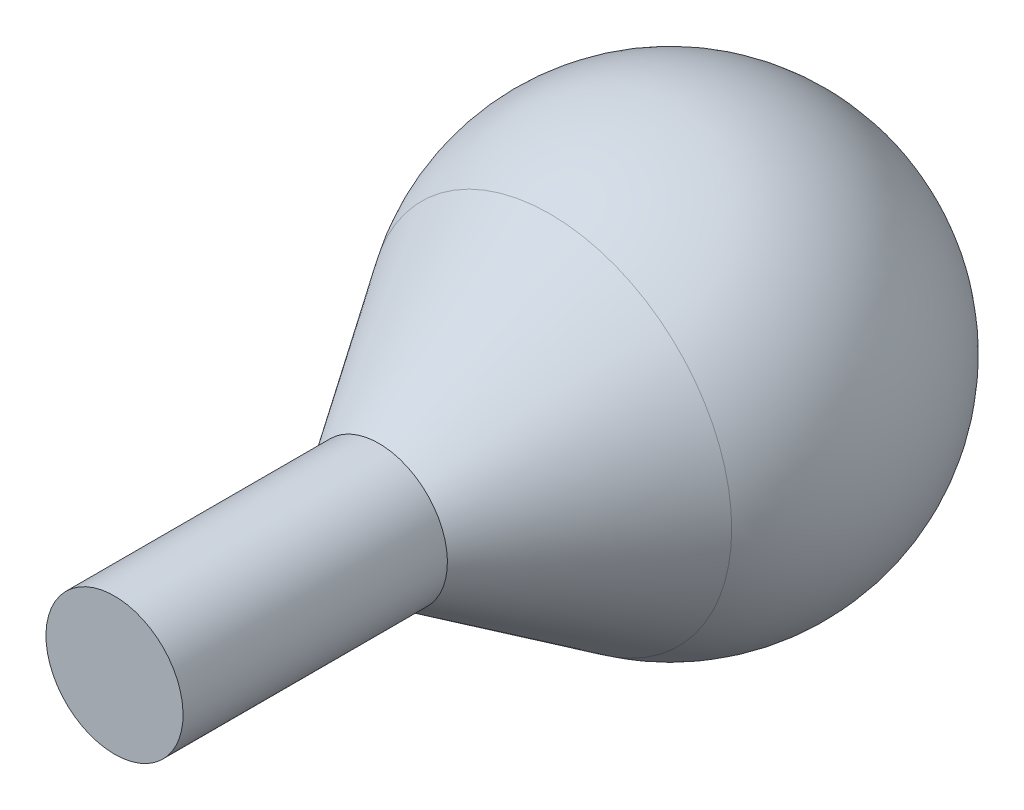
SolidWorks part; units mm, degrees
ref_plane "Plan de face" through (0, 0, 0) normal (0, 0, 1) x (1, 0, 0)
ref_plane "Plan de dessus" through (0, 0, 0) normal (0, 1, 0) x (1, 0, 0)
ref_plane "Plan de droite" through (0, 0, 0) normal (1, 0, 0) x (0, 0, -1)
sketch "Esquisse1" plane through (0, 0, 0) normal (1, 0, 0) x (0, 0, -1)
  line L0 (0, 0) -> (27, 0)
  line L1 (27, 0) -> (44.4759, 11.5583)
  line L2 (0, 0) -> (0, -7)
  line L3 (0, -7) -> (79, -7)
  line L4 (79, -7) -> (79, 115.9303) construction
  arc A0 (44.4759, 11.5583) -> (79, -7) centre (56.75, -7) cw
  point P7 (61.6981, 23.731)
  point P8 (48.4867, 7.8872)
  point P10 (73.7418, -13)
  dimension "D1" = 22.25
  dimension "D2" = 27
  dimension "D3" = 7
  dimension "D4" = 52
revolve "Révolution1" add sketch "Esquisse1" angle 360 about L3
